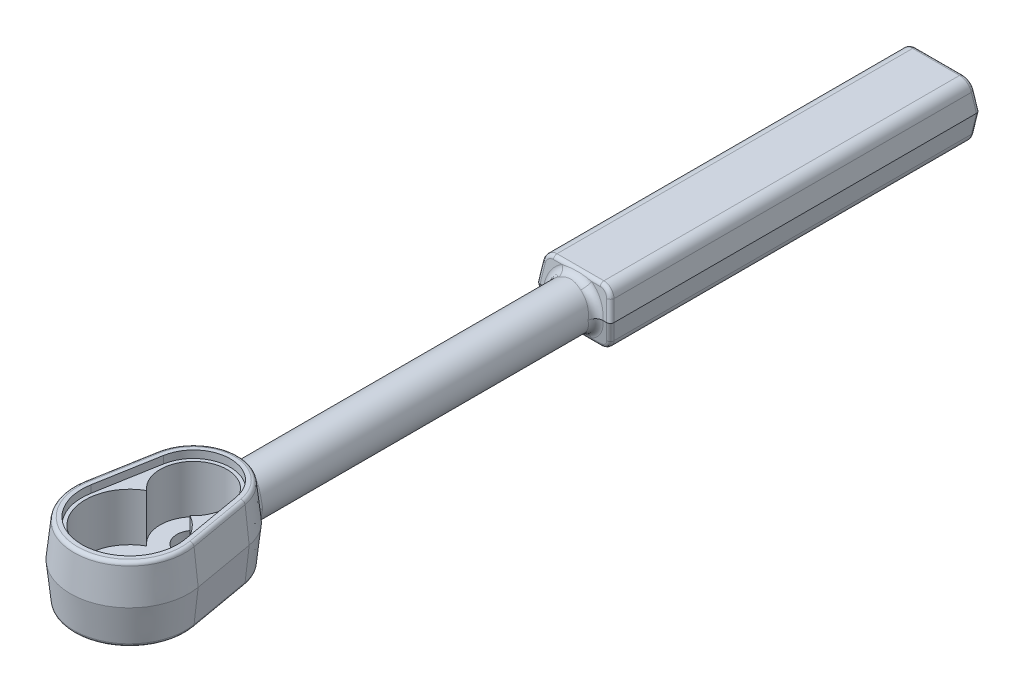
SolidWorks part; units mm, degrees
ref_plane "Front Plane" through (0, 0, 0) normal (0, 0, 1) x (1, 0, 0)
ref_plane "Top Plane" through (0, 0, 0) normal (0, 1, 0) x (1, 0, 0)
ref_plane "Right Plane" through (0, 0, 0) normal (1, 0, 0) x (0, 0, -1)
sketch "Sketch1" plane through (0, 0, 0) normal (0, 1, 0) x (1, 0, 0)
  line L0 (0, 0) -> (0, 220) construction
  line L1 (-10, 220) -> (10, 220)
  line L2 (10, 220) -> (10, 120)
  line L3 (-10, 220) -> (-10, 120)
  line L4 (10, 120) -> (0, 120)
  line L5 (-10, 120) -> (0, 120)
  dimension "D1" = 10
  dimension "D2" = 100
  dimension "D3" = 220
extrude "Handle" add sketch "Sketch1" along normal mid plane 15 draft 8
sketch "Sketch2" plane through (0, 0, 0) normal (0, 0, 1) x (1, 0, 0)
  circle A0 centre (0, 0) radius 6
  dimension "D1" = 12
extrude "Transition" add sketch "Sketch2" against normal up to next
sketch "Sketch3" plane through (0, 0, 0) normal (0, 1, 0) x (1, 0, 0)
  line L0 (0, 0) -> (0, 17.2763) construction
  line L1 (-12.8025, 19.5337) -> (-15.7569, 2.7784)
  line L2 (12.8025, 19.5337) -> (15.7569, 2.7784)
  arc A0 (15.7569, 2.7784) -> (-15.7569, 2.7784) centre (0, 0) cw
  arc A1 (-12.8025, 19.5337) -> (12.8025, 19.5337) centre (0, 17.2763) cw
  dimension "D1" = 13
  dimension "D2" = 16
  dimension "D4" = 20
extrude "Head" add sketch "Sketch3" along normal mid plane 20 draft 6
sketch "Sketch4" plane through (0, 10, 0) normal (0, 1, 0) x (-1, 0, 0)
  line L4 (9.7978, -19.0039) -> (12.7522, -2.2486)
  line L5 (-12.7522, -2.2486) -> (-9.7978, -19.0039)
  line L6 (9.7978, -19.0039) -> (12.7522, -2.2486)
  line L7 (-12.7522, -2.2486) -> (-9.7978, -19.0039)
  arc A4 (-9.7978, -19.0039) -> (9.7978, -19.0039) centre (0, -17.2763) ccw
  arc A5 (12.7522, -2.2486) -> (-12.7522, -2.2486) centre (0, 0) ccw
  arc A6 (-9.7978, -19.0039) -> (9.7978, -19.0039) centre (0, -17.2763) ccw
  arc A7 (12.7522, -2.2486) -> (-12.7522, -2.2486) centre (0, 0) ccw
  dimension "D1" = 2
extrude "Recess" cut sketch "Sketch4" against normal blind 2
sketch "Sketch5" plane through (0, 8, 0) normal (0, 1, 0) x (-1, 0, 0)
  arc A0 (-5.8786, -10.4615) -> (5.8786, -10.4615) centre (0, -17.2763) ccw
  arc A1 (5.8786, -10.4615) -> (-5.8786, -10.4615) centre (0, 0) ccw
  arc A2 (12.7522, -2.2486) -> (-12.7522, -2.2486) centre (0, 0) ccw construction
  dimension "D1" = 18
  dimension "D2" = 24
extrude "Pocket" cut sketch "Sketch5" against normal offset from surface (13 mm away) 5
sketch "Sketch6" plane through (0, -5, 0) normal (0, 1, 0) x (-1, 0, 0)
  circle A0 centre (0, -17.2763) radius 4.5
  dimension "D1" = 9
extrude "Wheel Hole" cut sketch "Sketch6" against normal through all
sketch "Sketch7" plane through (-4.6514, -5, 19.111) normal (0, 1, 0) x (-1, 0, 0)
  circle A0 centre (-4.6514, -19.111) radius 6
  arc A1 (1.2272, -29.5724) -> (-10.53, -29.5724) centre (-4.6514, -19.111) ccw construction
  dimension "D1" = 6
extrude "Ratchet Hole" cut sketch "Sketch7" against normal through all
fillet "Handle Fillets" radius 3 4 edges at (8.9459, 7.5, -170) (-8.9459, -7.5, -170) (8.9459, -7.5, -170) (-8.9459, 7.5, -170)
fillet "H End Fillets" radius 1 28 edges at (-8.3063, 6.7641, -219.0494) (8.3063, 6.7641, -219.0494) (9.6544, 2.4588, -120.3456) (-9.6544, 2.4588, -120.3456) (-8.3063, 6.7641, -120.9506) (8.3063, 6.7641, -120.9506) (0, 10, -29.2253) (-13.2446, 10, -10.9735) (0, 10, 14.949) (13.2446, 10, -10.9735) (0, -10, -29.2253) (13.2446, -10, -10.9735) (0, -10, 14.949) (-13.2446, -10, -10.9735) (-9.6544, -2.4588, -219.6544) (-9.6544, -2.4588, -120.3456) (0, -7.5, -121.0541) (9.6544, -2.4588, -120.3456) (8.3063, -6.7641, -120.9506) (-8.3063, -6.7641, -120.9506) (0, -7.5, -218.9459) (9.6544, -2.4588, -219.6544) (8.3063, -6.7641, -219.0494) (-8.3063, -6.7641, -219.0494) (0, 7.5, -121.0541) (0, 7.5, -218.9459) (-9.6544, 2.4588, -219.6544) (9.6544, 2.4588, -219.6544)
fillet "T-H Fillets" radius 2 4 edges at (0.2191, 5.996, -29.6442) (0.2191, -5.996, -29.6442) (0, -6, -120.8432) (0, 6, -120.8432)
